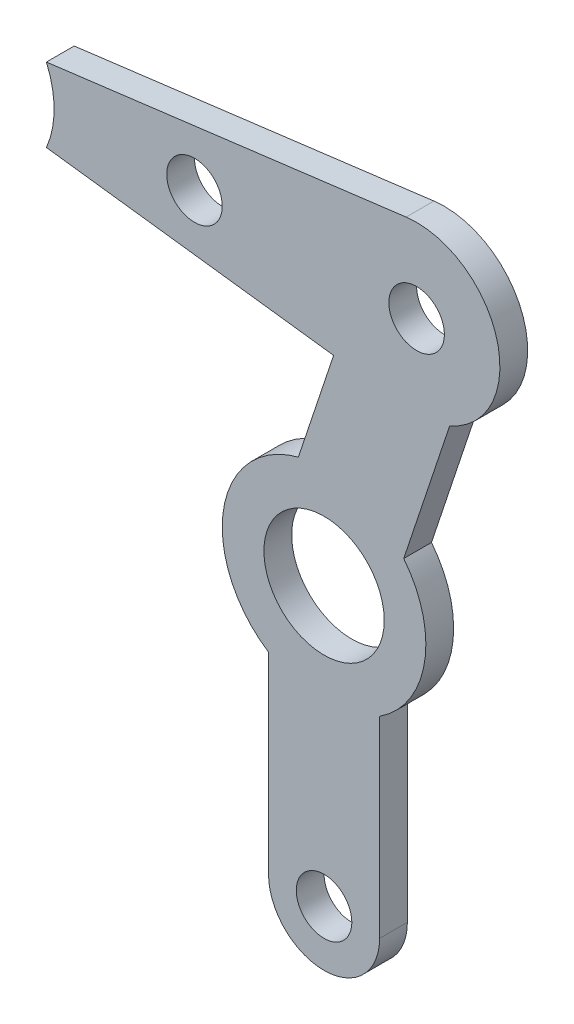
SolidWorks part; units mm, degrees
ref_plane "Face" through (0, 0, 0) normal (0, 0, 1) x (1, 0, 0)
ref_plane "Dessus" through (0, 0, 0) normal (0, 1, 0) x (1, 0, 0)
ref_plane "Droite" through (0, 0, 0) normal (1, 0, 0) x (0, 0, -1)
sketch "Esquisse1" plane through (0, 0, 0) normal (0, 0, 1) x (1, 0, 0)
  line L1 (3, -15) -> (3, -4.6098)
  line L3 (-3, -4.6098) -> (-3, -15)
  line L4 (2.154, 15.9487) -> (-1.3883, 5.3219)
  line L5 (7.846, 14.0513) -> (4.3038, 3.4245)
  line L6 (5, 15) -> (0, 0) construction
  line L7 (5, 15) -> (0, 0) construction
  circle A0 centre (0, 0) radius 3.25
  arc A1 (3, -4.6098) -> (4.3038, 3.4245) centre (0, 0) ccw
  arc A3 (-3, -15) -> (3, -15) centre (0, -15) ccw
  arc A5 (7.846, 14.0513) -> (2.154, 15.9487) centre (5, 15) ccw
  arc A6 (-1.3883, 5.3219) -> (-3, -4.6098) centre (0, 0) ccw
  dimension "D1" = 15
  dimension "D2" = 5
  dimension "D3" = 15
  dimension "D6" = 5.5
  dimension "D7" = 6.5
  dimension "D4" = 6
  dimension "D5" = 6
extrude "Extrusion1" add sketch "Esquisse1" along normal blind 1.5
sketch "Esquisse4" plane through (0, 0, 1.5) normal (0, 0, 1) x (1, 0, 0)
  line L0 (4.4339, 19.4643) -> (-15, 17)
  line L1 (4.4339, 10.5357) -> (-15, 13)
  line L2 (5, 15) -> (-19.5826, 15) construction
  arc A0 (4.4339, 10.5357) -> (4.4339, 19.4643) centre (5, 15) ccw
  arc A1 (7.846, 14.0513) -> (2.154, 15.9487) centre (5, 15) ccw construction
  arc A2 (-15, 17) -> (-15, 13) centre (-19.5826, 15) cw
  dimension "D1" = 9
  dimension "D3" = 4
  dimension "D4" = 5
  dimension "D2" = 20
extrude "Extrusion2" add sketch "Esquisse4" against normal blind 1.5
sketch "Esquisse2" plane through (0, 0, 1.5) normal (0, 0, 1) x (1, 0, 0)
  circle A0 centre (5, 15) radius 1.5
  circle A2 centre (0, -15) radius 1.5
  arc A3 (-3, -15) -> (3, -15) centre (0, -15) ccw construction
  arc A4 (6.7854, 10.8693) -> (4.4339, 19.4643) centre (5, 15) ccw construction
  circle A5 centre (-7, 15) radius 1.5
  dimension "D1" = 3
  dimension "D2" = 3
  dimension "D4" = 3
  dimension "D3" = 12
extrude "Enlèv. mat.-Extru.1" cut sketch "Esquisse2" against normal through all
